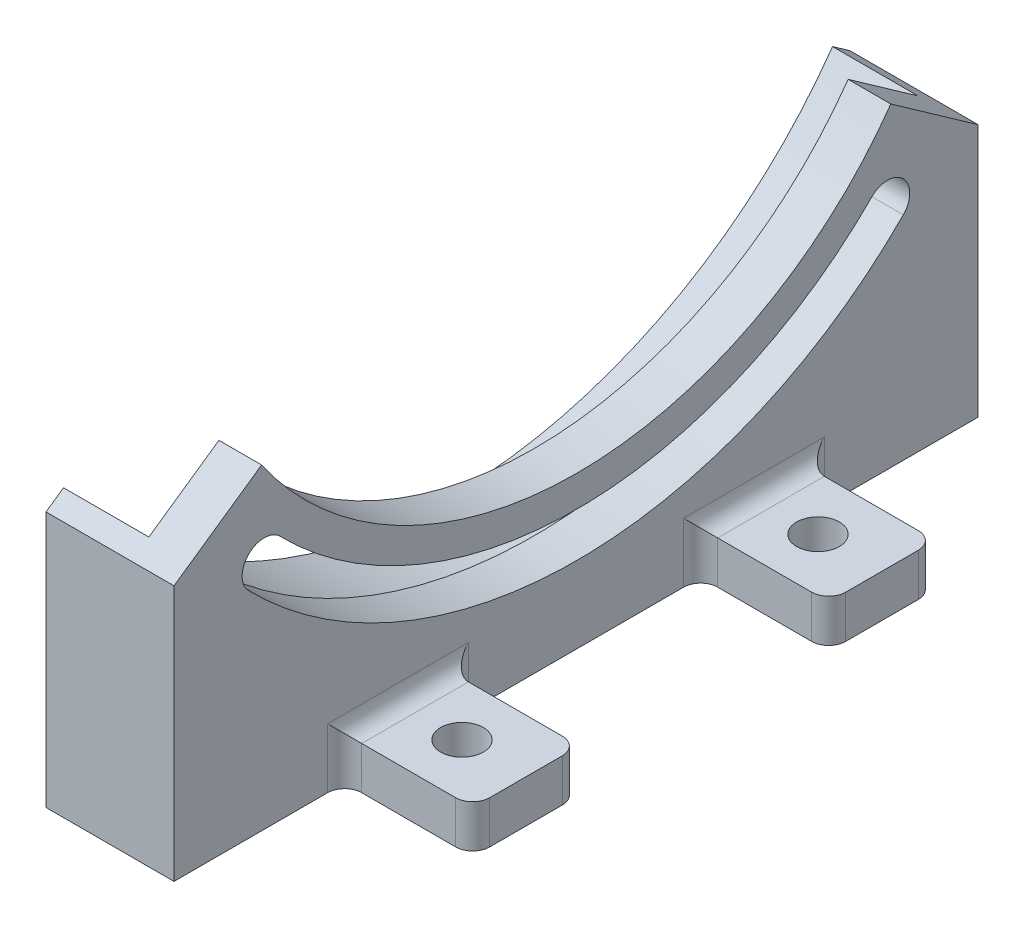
SolidWorks part; units mm, degrees
ref_plane "Front Plane" through (0, 0, 0) normal (0, 0, 1) x (1, 0, 0)
ref_plane "Top Plane" through (0, 0, 0) normal (0, 1, 0) x (1, 0, 0)
ref_plane "Right Plane" through (0, 0, 0) normal (1, 0, 0) x (0, 0, -1)
sketch "Sketch1" plane through (0, 0, 0) normal (1, 0, 0) x (0, 0, -1)
  line L0 (-73.025, 0) -> (73.025, 0)
  line L1 (0, 0) -> (-59.9616, -41.6805) construction
  line L2 (0, 0) -> (59.6943, -42.0623) construction
  line L3 (-59.9616, -41.6805) -> (-46.9264, -32.6195)
  line L4 (46.7173, -32.9184) -> (59.6943, -42.0623)
  arc A4 (-57.15, 0) -> (57.15, 0) centre (0, 0) ccw construction
  arc A5 (-65.0875, 0) -> (65.0875, 0) centre (0, 0) ccw construction
  arc A6 (-73.025, 0) -> (73.025, 0) centre (0, 0) ccw construction
  circle A7 centre (0, -65.0875) radius 3.175
  circle A8 centre (-46.0238, -46.0238) radius 3.175
  circle A14 centre (46.0238, -46.0238) radius 3.175
  circle A15 centre (-65.0875, 0) radius 3.175
  circle A16 centre (-46.0238, 46.0238) radius 3.175
  circle A17 centre (0, 65.0875) radius 3.175
  circle A18 centre (46.0238, 46.0238) radius 3.175
  circle A19 centre (65.0875, 0) radius 3.175
  arc A20 (-59.9616, -41.6805) -> (59.6943, -42.0623) centre (0, 0) ccw
  arc A21 (-46.9264, -32.6195) -> (46.7173, -32.9184) centre (0, 0) ccw
  point P29 (0, 0)
  dimension "D1" = 114.3
  dimension "D2" = 65.0875
  dimension "D3" = 7.9375
  dimension "D4" = 6.35
  dimension "D6" = 11.5216
  dimension "D7" = 11.1125
  dimension "D5" = 8
extrude "Boss-Extrude2" add sketch "Sketch1" along normal blind 6.35 contours L4 A20 L3 A21
sketch "Sketch2" plane through (6.35, 0, 0) normal (1, 0, 0) x (0, 0, -1)
  line L0 (-59.9616, -41.6805) -> (-46.9264, -32.6195) construction
  line L1 (46.7173, -32.9184) -> (59.6943, -42.0623) construction
  arc A0 (-53.444, -37.15) -> (53.2058, -37.4903) centre (0, 0) ccw construction
  circle A1 centre (-0.2077, -65.0872) radius 3.175 construction
  circle A2 centre (-46.1705, -45.8767) radius 3.175 construction
  circle A8 centre (45.8767, -46.1705) radius 3.175 construction
  circle A9 centre (-65.0872, 0.2077) radius 3.175
  circle A10 centre (-45.8767, 46.1705) radius 3.175
  circle A11 centre (46.1705, 45.8767) radius 3.175
  circle A12 centre (0.2077, 65.0872) radius 3.175
  circle A13 centre (65.0872, -0.2077) radius 3.175
  arc A14 (-44.1667, -43.2059) -> (-48.8875, -47.824) centre (-46.5271, -45.515) ccw
  arc A15 (48.5813, -48.1351) -> (43.89, -43.4869) centre (46.2357, -45.811) ccw
  arc A16 (-44.1667, -43.2059) -> (43.89, -43.4869) centre (0, 0) ccw
  arc A17 (-48.8875, -47.824) -> (48.5813, -48.1351) centre (0, 0) ccw
  point P26 (0, 0)
  dimension "D1" = 6.35
  dimension "D5" = 6.604
  dimension "D6" = 6.604
  dimension "D3" = 0.508
  dimension "D4" = 0.508
  dimension "D2" = 8
extrude "Cut-Extrude1" cut sketch "Sketch2" against normal blind 6.35
sketch "Sketch3" plane through (0, 0, 0) normal (-1, 0, 0) x (0, 0, 1)
  line L0 (-59.6943, -42.0623) -> (-57.0989, -40.2335)
  line L1 (-46.7173, -32.9184) -> (-59.6943, -42.0623) construction
  line L2 (59.9616, -41.6805) -> (57.3545, -39.8683)
  line L3 (59.9616, -41.6805) -> (46.9264, -32.6195) construction
  arc A0 (-59.6943, -42.0623) -> (59.9616, -41.6805) centre (0, 0) ccw
  arc A1 (-59.6943, -42.0623) -> (59.9616, -41.6805) centre (0, 0) ccw construction
  arc A2 (-57.0989, -40.2335) -> (57.3545, -39.8683) centre (0, 0) ccw
  dimension "D2" = 69.85
  dimension "D1" = 3.175
extrude "Boss-Extrude3" add sketch "Sketch3" along normal blind 12.7
sketch "Sketch4" plane through (6.35, 0, 0) normal (1, 0, 0) x (0, 0, -1)
  line L0 (-59.9616, -41.6805) -> (-59.9616, -79.7805)
  line L1 (-59.9616, -79.7805) -> (59.6943, -79.7805)
  line L2 (59.6943, -79.7805) -> (59.6943, -42.0623)
  arc A0 (-59.9616, -41.6805) -> (59.6943, -42.0623) centre (0, 0) ccw
  dimension "D1" = 38.1
extrude "Boss-Extrude4" add sketch "Sketch4" against normal through all
sketch "Sketch5" plane through (0, -79.7805, 0) normal (0, -1, 0) x (1, 0, 0)
  line L0 (6.35, 34.5616) -> (25.4, 34.5616)
  line L1 (6.35, 59.9616) -> (6.35, -59.6943) construction
  line L2 (25.4, 34.5616) -> (25.4, 18.6866)
  line L3 (25.4, 18.6866) -> (6.35, 18.6866)
  line L4 (6.35, 18.6866) -> (6.35, 34.5616)
  line L5 (6.35, -18.4193) -> (25.4, -18.4193)
  line L6 (25.4, -18.4193) -> (25.4, -34.2943)
  line L7 (25.4, -34.2943) -> (6.35, -34.2943)
  line L8 (6.35, -34.2943) -> (6.35, -18.4193)
  line L9 (-12.7, -59.6943) -> (6.35, -59.6943) construction
  line L10 (-12.7, 59.9616) -> (6.35, 59.9616) construction
  line L11 (6.35, 26.6241) -> (25.4, 26.6241) construction
  line L12 (6.35, -26.3568) -> (25.4, -26.3568) construction
  circle A0 centre (15.875, 26.6241) radius 3.175
  circle A1 centre (15.875, -26.3568) radius 3.175
  dimension "D7" = 6.35
  dimension "D8" = 6.35
  dimension "D1" = 15.875
  dimension "D2" = 15.875
  dimension "D3" = 19.05
  dimension "D4" = 19.05
  dimension "D5" = 25.4
  dimension "D6" = 25.4
  dimension "D9" = 9.525
  dimension "D10" = 9.525
extrude "Boss-Extrude5" add sketch "Sketch5" against normal blind 6.35
fillet "Fillet1" radius 2.54 10 edges at (6.35, -73.4305, 26.6241) (6.35, -73.4305, -26.3568) (6.35, -76.6055, -34.2943) (6.35, -76.6055, 18.6866) (6.35, -76.6055, 34.5616) (6.35, -76.6055, -18.4193) (25.4, -76.6055, -34.2943) (25.4, -76.6055, -18.4193) (25.4, -76.6055, 18.6866) (25.4, -76.6055, 34.5616)
